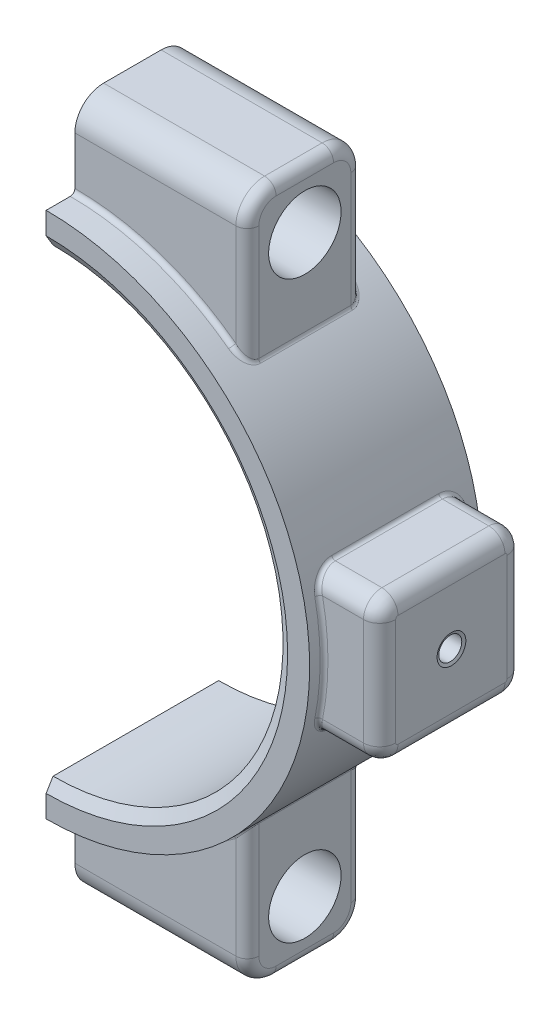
SolidWorks part; units mm, degrees
ref_plane "XY" through (0, 0, 0) normal (0, 0, 1) x (1, 0, 0)
ref_plane "YZ" through (0, 0, 0) normal (0, 1, 0) x (1, 0, 0)
ref_plane "XZ" through (0, 0, 0) normal (1, 0, 0) x (0, 0, -1)
imported_body "Imported1"
hole_wizard "Ø8.0 (8) Diameter Hole1" positions "Sketch2" profile "Sketch3" hole size "Ø8.0" standard "Ansi Metric"
sketch "Sketch2" plane through (-0.2637, 0, 0) normal (1, 0, 0) x (0, 0, -1)
  point P0 (-81.3971, 31.555)
  point P1 (-81.3971, -31.945)
sketch "Sketch3" plane through (-0.2637, 31.555, 81.3971) normal (0, 1, 0) x (0, 0, -1)
  line L0 (0, 0) -> (0, 22.7234)
  line L1 (0, 22.7234) -> (4, 20.32)
  line L2 (4, 20.32) -> (4, 0)
  line L5 (4, 0) -> (0, 0)
  line L10 (0, 22.7234) -> (-4, 20.32) construction
  line L11 (0, -6.35) -> (0, 107.95) construction
  dimension "Hole Dia." = 8
  dimension "Hole Depth" = 20.32
  dimension "Drill Angle" = 118
